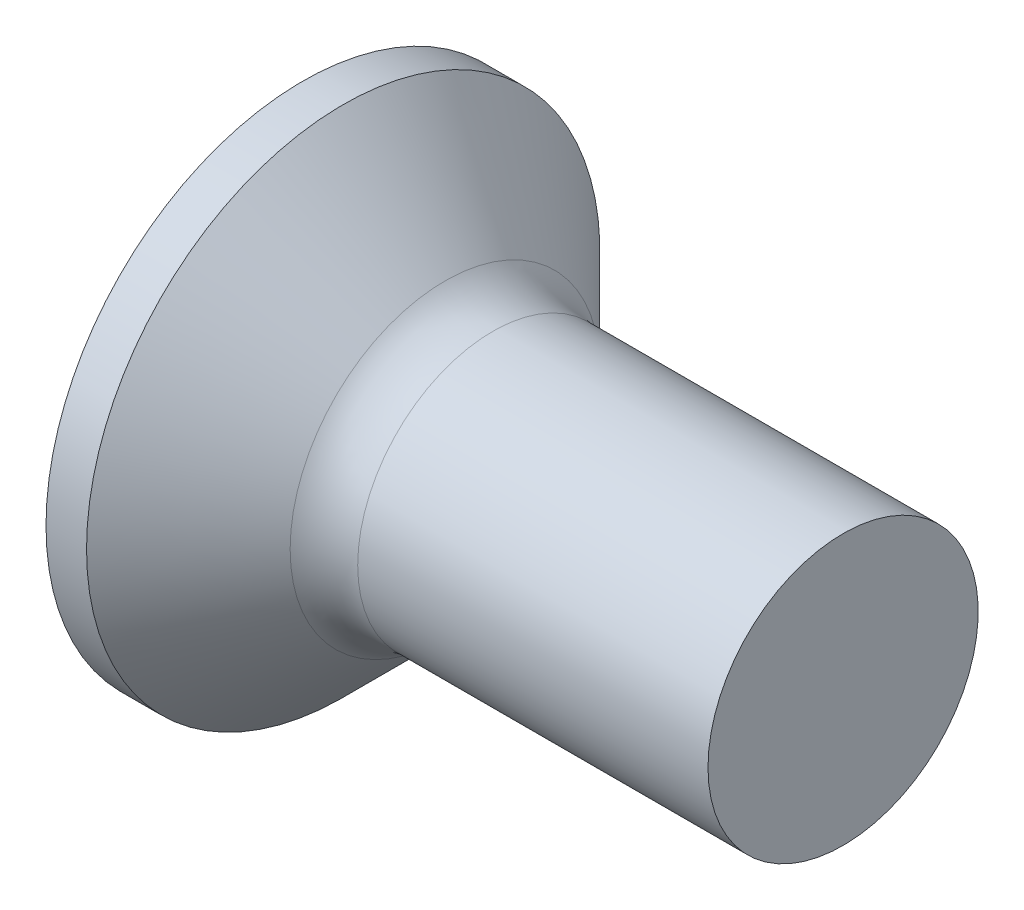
SolidWorks part; units mm, degrees
revolve "Base-Revolve" add sketch "BodySke"
sketch "BodySke" plane through (0, 0, 0) normal (0, 0, 1) x (1, 0, 0)
  line L0 (0, 0) -> (0, 1.9)
  line L1 (0, 1.9) -> (0.3, 1.9)
  line L2 (1.2, 1) -> (4, 1)
  line L3 (4, 1) -> (4, 0)
  line L4 (4, 0) -> (0, 0)
  line L5 (-6.35, 0) -> (82.55, 0) construction
  line L6 (1.2, -1) -> (4, -1) construction
  line L7 (0.3, -1.9) -> (1.2, -1) construction
  line L8 (0.3, 1.9) -> (1.2, 1)
  line L9 (0, -1.9) -> (0.3, -1.9) construction
  line L10 (1.6, 2.5875) -> (1.6, -6.9375) construction
  line L11 (0, 6.35) -> (0, -3.175) construction
fillet "Fillet1" radius 0.5 1 edges at (1.2, 0, 1)
ref_plane "Plane1" through (0, 0, 0) normal (0, 0, 1) x (1, 0, 0)
ref_plane "Plane2" through (0, 0, 0) normal (0, 1, 0) x (1, 0, 0)
ref_plane "Plane3" through (0, 0, 0) normal (1, 0, 0) x (0, 0, -1)
sketch "Sketch3" plane through (0, 0, 0) normal (-1, 0, 0) x (0, 0, 1)
  line L0 (-0.24, 0.95) -> (0.24, 0.95)
  line L1 (0.24, 0.95) -> (0.24, -0.95)
  line L2 (0.24, -0.95) -> (-0.24, -0.95)
  line L3 (-0.24, -0.95) -> (-0.24, 0.95)
ref_plane "Plane4" through (1.2, 0, 0) normal (-1, 0, 0) x (0, 0, 1)
sketch "Sketch4" plane through (1.2, 0, 0) normal (-1, 0, 0) x (0, 0, 1)
  line L0 (-0.24, 0.3517) -> (0.24, 0.3517)
  line L3 (0.24, 0.3517) -> (0.24, -0.3517)
  line L4 (0.24, -0.3517) -> (-0.24, -0.3517)
  line L5 (-0.24, -0.3517) -> (-0.24, 0.3517)
loft "Recess" cut profiles "Sketch3", "Sketch4"
pattern_circular "RecPat" count 2 every 90 about axis through (0, 0, 0) along (1, 0, 0) of "Recess"
sketch "RecCorSke" plane through (0, 0, 0) normal (0, 0, 1) x (1, 0, 0)
  line L0 (-3.175, 0) -> (15.875, 0) construction
  line L2 (0, 0) -> (0, 0.4394)
  line L3 (0, 0.4394) -> (1.2, 0.3555)
  line L4 (1.2, 0.3555) -> (1.3155, 0)
  line L5 (1.3155, 0) -> (0, 0)
revolve "RecessCore" cut sketch "RecCorSke" angle 360 about L0
sketch "ThdSchSke" plane through (0, 0, 0) normal (0, 0, 1) x (1, 0, 0)
  line L0 (1.6, -0.774) -> (1.4418, -1)
  line L1 (1.6, -0.774) -> (1.7582, -1)
  line L2 (1.7582, -1) -> (1.7582, -1.25)
  line L3 (-3.175, 0) -> (5.1513, 0) construction
  line L5 (1.7582, -1.25) -> (1.4418, -1.25)
  line L6 (1.4418, -1.25) -> (1.4418, -1)
  line L7 (0, 1.9) -> (0, -1.9) construction
revolve "ThreadSchematic" [suppressed] cut sketch "ThdSchSke" angle 360 about L3
pattern_linear "ThdSchPat" [suppressed]
equation "\"D1@Sketch3\" = \"Cross_dia@Sketch3\" / 2"
equation "\"D2@Sketch3\" = \"Cross_width@Sketch3\" / 2"
equation "\"Depth@RecCorSke\" = \"Cross_depth@Plane4\""
equation "\"D1@Sketch4\" = \"Cross_width@Sketch3\""
equation "\"D2@Sketch4\" = \"Cross_dia@Sketch3\" - 2.0 * \"Cross_depth@Plane4\" * tan(26.5  * 0.017453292)"
equation "\"D3@Sketch4\" = \"D1@Sketch4\" / 2"
equation "\"D4@Sketch4\" = \"D2@Sketch4\" / 2"
equation "\"Thread_length@ThreadCosmetic\" = ((sgn( (\"Length@BodySke\" - \"Advance@BodySke\" * 1.0 - \"Head_ht@BodySke\" ) - \"Thread_nom@BodySke\" )-1)*( (\"Length@BodySke\" - \"Advance@BodySke\" * 1.0 - \"Head_ht@BodySke\" "
equation "\"Thread_minor@ThdSchSke\" = \"Thread_minor@ThreadCosmetic\""
equation "\"Diameter@ThdSchSke\" = \"Diameter@BodySke\""
equation "\"Overcut@ThdSchSke\" = \"Diameter@BodySke\" * 1.25"
equation "\"Start@ThdSchSke\" = 0.000001 + \"Length@BodySke\" - \"Thread_length@ThreadCosmetic\"  '---Countersunk---"
equation "\"Num_threads@ThdSchPat\" = int( \"Thread_length@ThreadCosmetic\" / \"Advance@BodySke\" + 0.999 )  + 1"
equation "\"Advance@ThdSchPat\" = \"Thread_length@ThreadCosmetic\" /  (\"Num_threads@ThdSchPat\" - 1) 'relax it"
